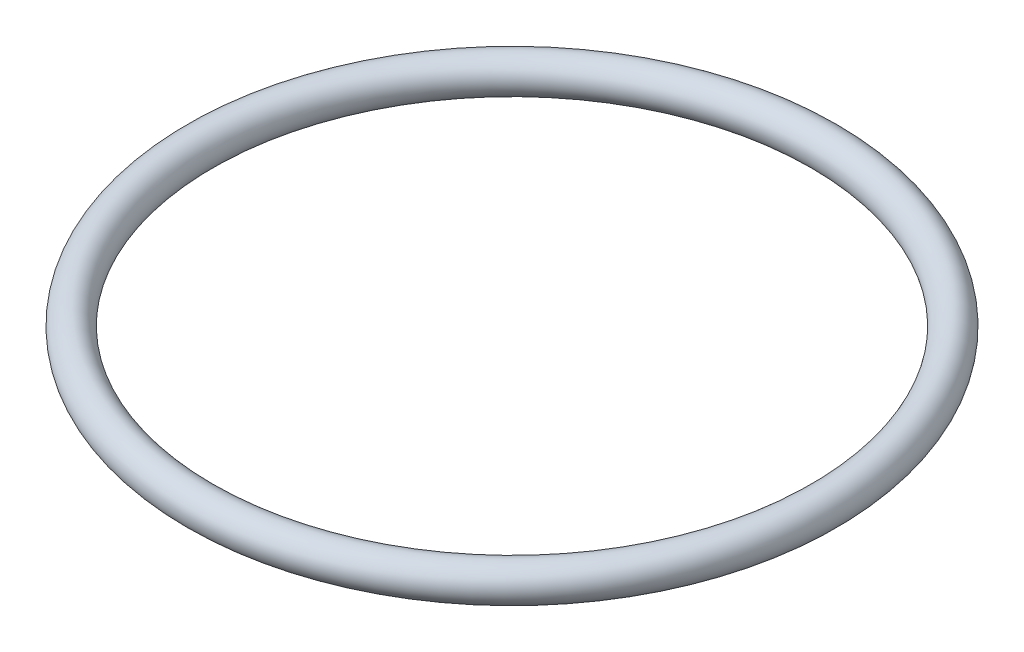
SolidWorks part; units mm, degrees
ref_plane "face" through (0, 0, 0) normal (0, 0, 1) x (1, 0, 0)
ref_plane "dessus" through (0, 0, 0) normal (0, 1, 0) x (1, 0, 0)
ref_plane "profil" through (0, 0, 0) normal (1, 0, 0) x (0, 0, -1)
sketch "Esquisse1" plane through (0, 0, 0) normal (0, 0, 1) x (1, 0, 0)
  line L0 (0, 11.7008) -> (0, -7.0914) construction
  circle A0 centre (17.5, 0) radius 1
  dimension "D2" = 2
  dimension "D1" = 17.5
revolve "Base-Révolution" add sketch "Esquisse1" angle 360 about L0
